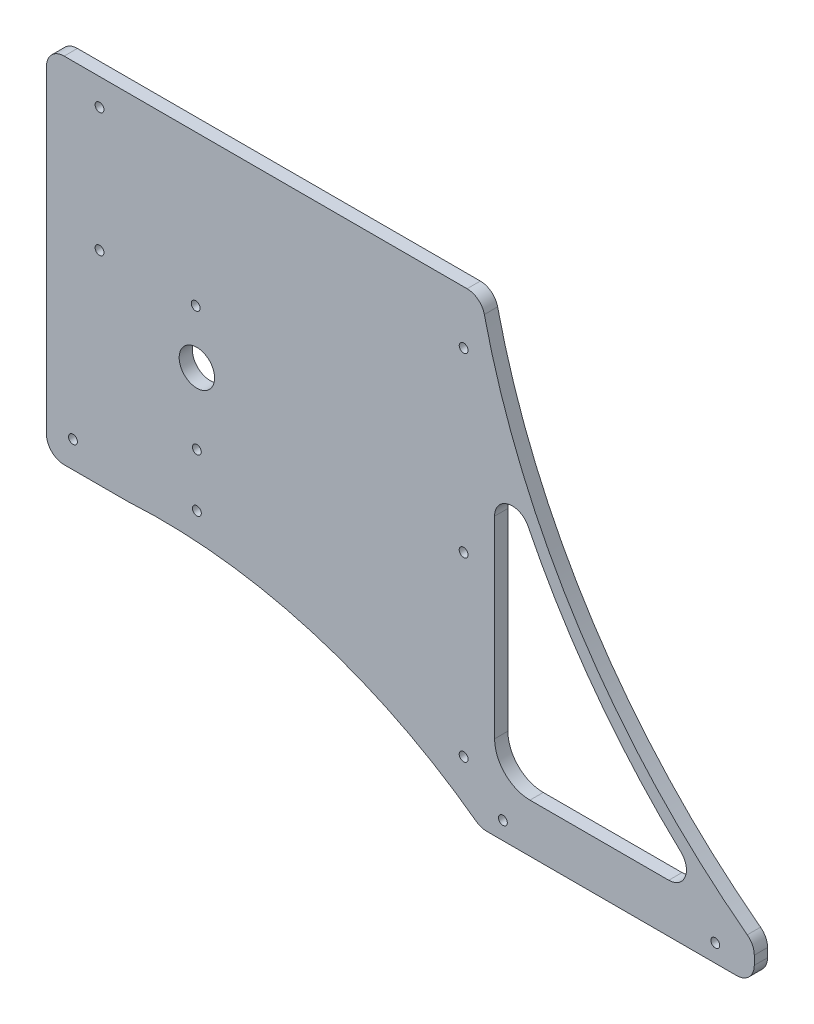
SolidWorks part; units mm, degrees
ref_plane "Front Plane" through (0, 0, 0) normal (0, 0, 1) x (1, 0, 0)
ref_plane "Top Plane" through (0, 0, 0) normal (0, 1, 0) x (1, 0, 0)
ref_plane "Right Plane" through (0, 0, 0) normal (1, 0, 0) x (0, 0, -1)
sketch "Sketch1" plane through (0, 0, 0) normal (0, 0, 1) x (1, 0, 0)
  line L1 (-133.35, 660.4) -> (374.65, 660.4)
  line L2 (-133.35, 660.4) -> (-133.35, 323.9)
  line L3 (-133.35, 323.9) -> (374.65, 323.9)
  line L4 (374.65, 660.4) -> (374.65, 323.9)
  line L5 (-133.35, 660.4) -> (374.65, 323.9) construction
  line L6 (-133.35, 323.9) -> (374.65, 660.4) construction
  line L7 (358.3496, 323.9) -> (633.3496, 323.9)
  line L9 (633.3496, 348.9) -> (178.3496, 348.9)
  line L12 (178.3496, 204.6823) -> (178.3496, 323.9)
  line L13 (153.3496, 801.4) -> (153.3496, 204.6823)
  line L14 (-133.35, 654.1) -> (374.65, 654.1)
  point P4 (120.65, 492.15)
  dimension "D1" = 330.2
  dimension "D2" = 508
extrude "Boss-Extrude1" add sketch "Sketch1" along normal blind 9.525
sketch "Sketch2" plane through (0, 0, 9.525) normal (0, 0, 1) x (1, 0, 0)
  line L0 (-133.35, 323.9) -> (374.65, 323.9) construction
  line L1 (178.7496, 336.6) -> (323.85, 336.6)
  line L2 (153.3496, 801.4) -> (153.3496, 204.6823) construction
  line L3 (-133.35, 323.9) -> (374.65, 323.9) construction
  line L4 (-133.35, 349.3) -> (374.65, 349.3) construction
  line L5 (153.3496, 801.4) -> (153.3496, 204.6823) construction
  line L6 (178.7496, 801.4) -> (178.7496, 204.6823) construction
  line L8 (166.0496, 654.1) -> (166.0496, 323.9)
  line L9 (-133.35, 654.1) -> (374.65, 654.1) construction
  line L10 (178.7496, 349.3) -> (178.7496, 323.9)
  circle A0 centre (-114.3, 469.9) radius 3.175 construction
  circle A1 centre (-114.3, 419.1) radius 3.175 construction
  circle A2 centre (-25.4, 419.1) radius 3.175 construction
  circle A3 centre (-25.4, 457.2) radius 3.175 construction
  circle A4 centre (-95.25, 635) radius 3.175 construction
  circle A5 centre (-25.4, 508) radius 12.7 construction
  circle A6 centre (-95.25, 546.1) radius 3.175 construction
  circle A7 centre (-26.2526, 546.0905) radius 3.175 construction
  circle A8 centre (-114.3, 469.9) radius 3.175
  circle A9 centre (-114.3, 419.1) radius 3.175
  circle A10 centre (-25.4, 419.1) radius 3.175
  circle A11 centre (-25.4, 457.2) radius 3.175
  circle A12 centre (-95.25, 635) radius 3.175
  circle A13 centre (-25.4, 508) radius 12.7
  circle A14 centre (-95.25, 546.1) radius 3.175
  circle A15 centre (-26.2526, 546.0905) radius 3.175
  circle A16 centre (166.0496, 616) radius 3.175
  circle A17 centre (166.0496, 489) radius 3.175
  circle A18 centre (166.0496, 362) radius 3.175
  circle A19 centre (194.2412, 336.6) radius 3.175
  circle A20 centre (346.6412, 336.6) radius 3.175
  dimension "D2" = 12.7
  dimension "D3" = 38.1
  dimension "D1" = 25.4
  dimension "D5" = 25.4
  dimension "D4" = 3
  dimension "D7" = 2
extrude "Cut-Extrude1" cut sketch "Sketch2" against normal through all contours A12 | A14 | A15 | A13 | A9 | A10 | A11 | L8 A16 | L8 A16 | L8 A17 | L8 A17 | L8 A18 | L8 A18 | L1 A19 | L1 A19 | A20
sketch "Sketch3" plane through (0, 0, 9.525) normal (0, 0, 1) x (1, 0, 0)
  line L0 (-133.35, 323.9) -> (374.65, 323.9) construction
  line L1 (153.3496, 801.4) -> (153.3496, 204.6823) construction
  line L2 (-133.35, 323.9) -> (374.65, 323.9)
  line L3 (153.3496, 801.4) -> (153.3496, 341.2503)
  line L4 (178.7496, 654.1) -> (178.7496, 323.9)
  line L5 (374.65, 358.825) -> (374.65, 349.3)
  line L6 (374.65, 660.4) -> (374.65, 323.9) construction
  line L8 (374.65, 660.4) -> (374.65, 654.1)
  line L9 (178.7496, 801.4) -> (178.7496, 204.6823) construction
  line L10 (188.2746, 593.2527) -> (188.2746, 384.225)
  line L16 (153.3496, 801.4) -> (153.3496, 204.6823) construction
  line L17 (-133.35, 358.825) -> (346.9352, 358.825) construction
  line L18 (213.6746, 358.825) -> (346.9352, 358.825)
  line L26 (178.1982, 333.425) -> (178.7496, 333.425)
  line L28 (188.2746, 801.4) -> (188.2746, 204.6823) construction
  line L66 (153.3496, 349.3) -> (374.65, 349.3)
  line L67 (-133.35, 349.3) -> (374.65, 349.3) construction
  line L146 (-74.6125, 400.1) -> (-187.7534, 400.1)
  line L151 (374.65, 654.1) -> (-133.35, 654.1)
  line L152 (-133.35, 654.1) -> (-133.35, 323.9)
  line L153 (-133.35, 323.9) -> (374.65, 323.9)
  line L154 (374.65, 323.9) -> (374.65, 654.1)
  line L157 (-133.35, 323.9) -> (374.65, 323.9)
  line L158 (374.65, 349.3) -> (374.65, 358.825)
  arc A0 (374.65, 349.3) -> (178.7496, 654.1) centre (675.9474, 758.3035) cw
  arc A1 (346.9352, 358.825) -> (178.7496, 614.6842) centre (675.9474, 758.3035) cw
  circle A4 centre (166.0496, 362) radius 3.175 construction
  arc A9 (178.3496, 323.9) -> (-74.6125, 400.1) centre (-51.2067, 19.8196) ccw
  arc A11 (346.9352, 358.825) -> (169.4272, 652.1462) centre (675.9474, 758.3035) cw construction
  circle A14 centre (166.0496, 362) radius 3.175
  arc A31 (213.6746, 358.825) -> (188.2746, 384.225) centre (213.6746, 384.225) cw
  arc A34 (178.7496, 333.0995) -> (178.1982, 333.425) centre (-74.6125, -95.4078) ccw
  point P87 (-123.825, 358.825)
  dimension "D3" = 508
  dimension "D10" = 25.4
  dimension "D6" = 381
  dimension "D5" = 76.2
  dimension "D4" = 9.525
  dimension "D22" = 0
extrude "Cut-Extrude2" cut sketch "Sketch3" against normal through all
fillet "Fillet1" radius 12.7 6 edges at (-133.35, 654.1, 4.7625) (178.7496, 654.1, 4.7625) (374.65, 349.3, 4.7625) (374.65, 323.9, 4.7625) (178.3496, 323.9, 4.7625) (-133.35, 400.1, 4.7625)
fillet "Fillet2" radius 12.7 2 edges at (188.2746, 585.0771, 4.7625) (346.9352, 358.825, 4.7625)
